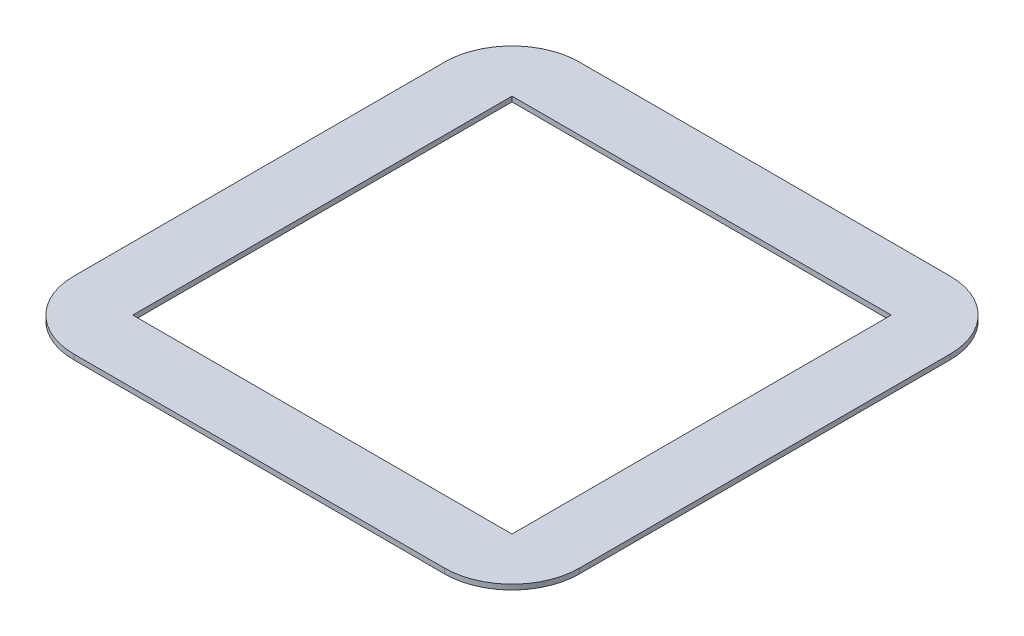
SolidWorks part; units mm, degrees
ref_plane "Alzado" through (0, 0, 0) normal (0, 0, 1) x (1, 0, 0)
ref_plane "Planta" through (0, 0, 0) normal (0, 1, 0) x (1, 0, 0)
ref_plane "Vista lateral" through (0, 0, 0) normal (1, 0, 0) x (0, 0, -1)
sketch "Croquis1" plane through (0, 0, 0) normal (0, 1, 0) x (1, 0, 0)
  line L1 (-150, 150) -> (150, 150)
  line L2 (-150, 150) -> (-150, -150)
  line L3 (-150, -150) -> (150, -150)
  line L4 (150, 150) -> (150, -150)
  line L5 (-150, 150) -> (150, -150) construction
  line L6 (-150, -150) -> (150, 150) construction
  line L7 (112.5, 112.5) -> (-112.5, 112.5)
  line L8 (112.5, 112.5) -> (112.5, -112.5)
  line L9 (112.5, -112.5) -> (-112.5, -112.5)
  line L10 (-112.5, 112.5) -> (-112.5, -112.5)
  line L11 (112.5, 112.5) -> (-112.5, -112.5) construction
  line L12 (112.5, -112.5) -> (-112.5, 112.5) construction
  point P0 (0, 0)
  point P6 (0, 0)
  dimension "D1" = 300
  dimension "D2" = 225
extrude "Saliente-Extruir1" add sketch "Croquis1" along normal blind 3
fillet "Redondeo1" radius 40 4 edges at (-150, 1.5, -150) (-150, 1.5, 150) (150, 1.5, -150) (150, 1.5, 150)
